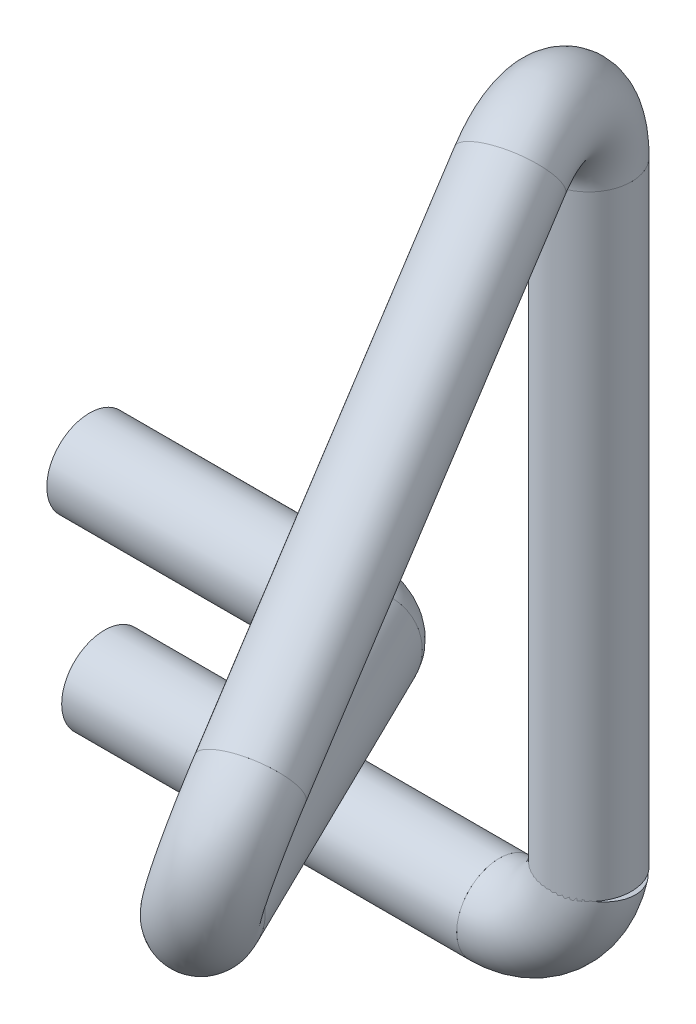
SolidWorks part; units mm, degrees
ref_plane "Ebene vorne" through (0, 0, 0) normal (0, 0, 1) x (1, 0, 0)
ref_plane "Ebene oben" through (0, 0, 0) normal (0, 1, 0) x (1, 0, 0)
ref_plane "Ebene rechts" through (0, 0, 0) normal (1, 0, 0) x (0, 0, -1)
sketch3d "3D-Skizze2"
  line L0 (0, 0, 0) -> (98.5728, 0, 0)
  line L1 (118.4386, 17.5182, -2.4398) -> (118.4386, 170.8718, -2.4398)
  line L2 (128.1783, 187.6065, 26.9402) -> (160.3086, 120.7788, 123.8629)
  line L3 (-8.276, 40.5055, -4.5616) -> (51.8203, 40.5055, -4.5616)
  line L4 (68.7197, 43.6489, 4.1949) -> (149.1664, 86.592, 123.8198)
  arc A0 (98.5728, 0, 0) -> (118.4386, 17.5182, -2.4398) centre (98.5728, 19.8088, -2.7588) ccw
  arc A1 (118.4386, 170.8718, -2.4398) -> (128.1783, 187.6065, 26.9402) centre (124.7319, 170.8718, 16.5443) ccw
  arc A2 (51.8203, 40.5055, -4.5616) -> (68.7197, 43.6489, 4.1949) centre (51.8203, 47.2629, 14.2622) ccw
  arc A3 (160.3086, 120.7788, 123.8629) -> (149.1664, 86.592, 123.8198) centre (150.8477, 104.963, 116.0944) ccw
  point P4 (98.5728, 22.5676, 17.05)
  point P8 (143.716, 170.8718, 10.251)
  point P15 (62.831, 40.5055, -4.5616)
  point P16 (51.8203, 28.4391, 21.0197)
  point P19 (171.1128, 98.3072, 156.4543)
  point P20 (167.6632, 99.4942, 106.7493)
  dimension "D1" = 20
  dimension "D2" = 20
  dimension "D3" = 20
other "Strukturbauteil1"
ref_plane "Ebene2" through (-8.276, 40.5055, -4.5616) normal (1, 0, 0) x (0, 0, -1)
sketch "Sketch1" plane through (-8.276, 40.5055, -4.5616) normal (1, 0, 0) x (0, 0, -1)
  circle A0 centre (0, 0) radius 8.35
  circle A1 centre (0, 0) radius 10.65
  point P3 (0, 0)
  dimension "In_dia" = 16.7
  dimension "Out_dia" = 21.3
equation "\"LÄNGE\"=0"
equation "\"BREITE\"=0"
equation "\"HÖHE\"=0"
equation "\"DURCHMESSER\"=0"
equation "\"Stückzahl\"= 1"
